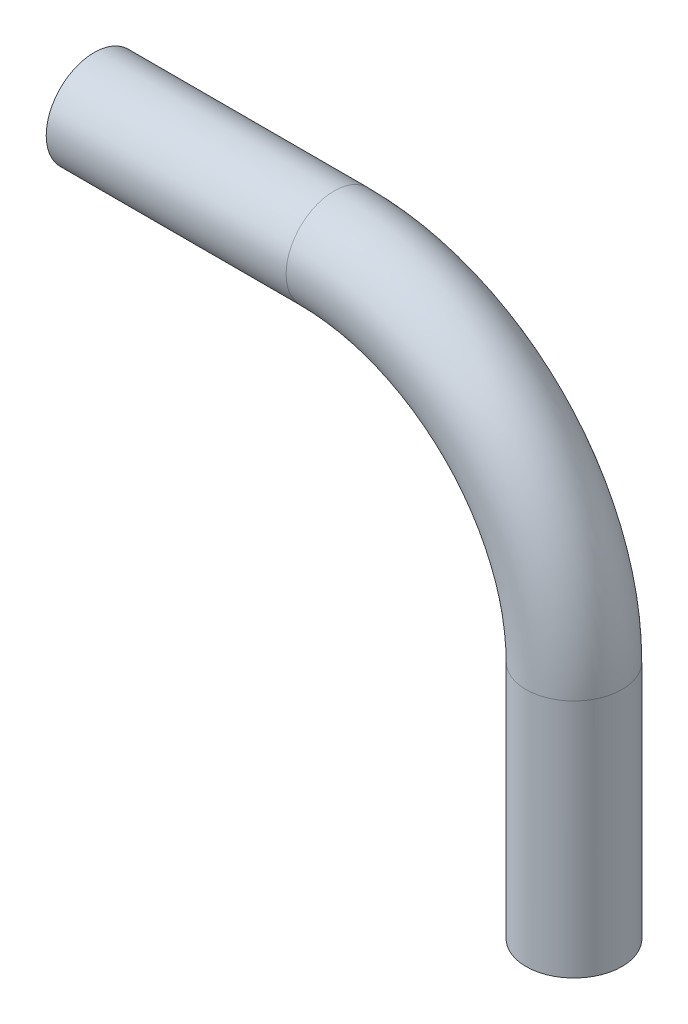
SolidWorks part; units mm, degrees
ref_plane "Front" through (0, 0, 0) normal (0, 0, 1) x (1, 0, 0)
ref_plane "Top" through (0, 0, 0) normal (0, 1, 0) x (1, 0, 0)
ref_plane "Right" through (0, 0, 0) normal (1, 0, 0) x (0, 0, -1)
sketch "Sketch1" plane through (0, 0, 0) normal (0, 0, 1) x (1, 0, 0)
  line L0 (0, 23.8125) -> (0, 0)
  line L1 (-23.8125, 47.625) -> (-47.625, 47.625)
  arc A0 (0, 23.8125) -> (-23.8125, 47.625) centre (-23.8125, 23.8125) ccw
  dimension "D1" = 47.625
  dimension "D2" = 23.8125
  dimension "D3" = 23.8125
sketch "Sketch2" plane through (0, 0, 0) normal (0, 1, 0) x (1, 0, 0)
  circle A0 centre (0, 0) radius 4.7625
  circle A1 centre (0, 0) radius 3.8735
  dimension "D1" = 0.889
  dimension "D2" = 9.525
sweep "Sweep1" add profiles "Sketch2" path "Sketch1"
